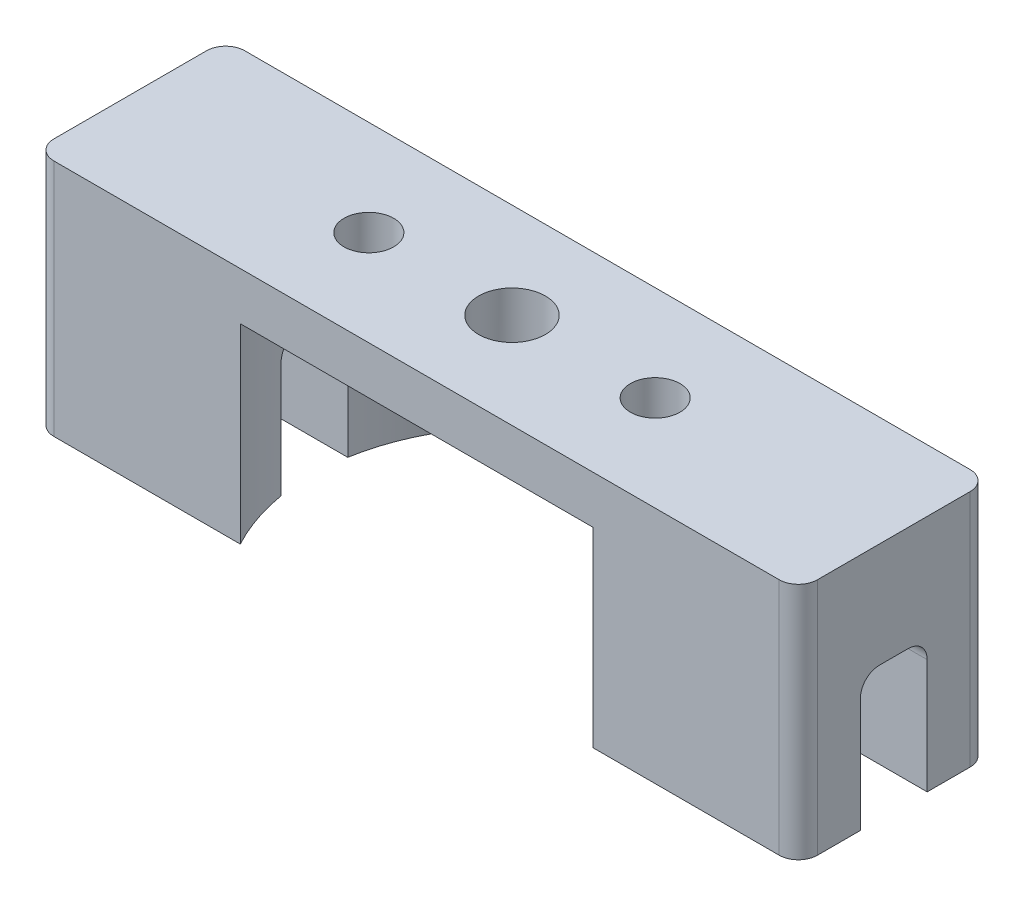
SolidWorks part; units mm, degrees
ref_plane "Front Plane" through (0, 0, 0) normal (0, 0, 1) x (1, 0, 0)
ref_plane "Top Plane" through (0, 0, 0) normal (0, 1, 0) x (1, 0, 0)
ref_plane "Right Plane" through (0, 0, 0) normal (1, 0, 0) x (0, 0, -1)
sketch "Sketch1" plane through (0, 0, 0) normal (0, 1, 0) x (1, 0, 0)
  line L1 (0, 0) -> (101.6, 0)
  line L2 (0, 0) -> (0, 25.4)
  line L3 (0, 25.4) -> (101.6, 25.4)
  line L4 (101.6, 0) -> (101.6, 25.4)
  dimension "D1" = 101.6
  dimension "D2" = 25.4
extrude "Boss-Extrude1" add sketch "Sketch1" along normal blind 31.75
sketch "Sketch2" plane through (101.6, 0, 0) normal (1, 0, 0) x (0, 0, -1)
  line L0 (12.7, 0) -> (12.7, 31.75) construction
  line L1 (0, 0) -> (25.4, 0) construction
  line L2 (0, 31.75) -> (25.4, 31.75) construction
  line L3 (8.255, 0) -> (8.255, 17.78)
  line L4 (8.255, 17.78) -> (17.145, 17.78)
  line L5 (12.7, 17.78) -> (12.7, 0)
  line L6 (17.145, 0) -> (8.255, 0)
  line L7 (17.145, 0) -> (17.145, 17.78)
  dimension "D1" = 4.445
  dimension "D2" = 17.78
extrude "Cut-Extrude1" cut sketch "Sketch2" against normal through all contours L7 L4 L5 M6 | L5 L4 L3 M6
fillet "Fillet1" radius 2.54 2 edges at (50.8, 17.78, -17.145) (50.8, 17.78, -8.255)
sketch "Sketch3" plane through (0, 0, 0) normal (0, -1, 0) x (1, 0, 0)
  line L0 (50.8, -25.4) -> (50.8, 0) construction
  line L1 (101.6, -25.4) -> (0, -25.4) construction
  line L2 (0, 0) -> (101.6, 0) construction
  line L3 (0, -12.7) -> (50.8, -12.7) construction
  line L4 (0, -10.795) -> (0, -14.605) construction
  circle A0 centre (50.8, -12.7) radius 26.67
  dimension "2.1" = 53.34
extrude "Cut-Extrude2" cut sketch "Sketch3" against normal blind 25.4
sketch "Sketch4" plane through (0, 31.75, 0) normal (0, 1, 0) x (1, 0, 0)
  line L0 (50.8, 0) -> (50.8, 25.4) construction
  line L1 (0, 0) -> (101.6, 0) construction
  line L2 (101.6, 25.4) -> (0, 25.4) construction
  line L3 (0, 12.7) -> (50.8, 12.7) construction
  line L4 (0, 25.4) -> (0, 0) construction
  circle A0 centre (50.8, 12.7) radius 4.445
  circle A1 centre (31.75, 12.7) radius 3.302
  circle A2 centre (69.85, 12.7) radius 3.302
  dimension "D1" = 8.89
  dimension "D2" = 6.604
  dimension "D3" = 19.05
extrude "Cut-Extrude3" cut sketch "Sketch4" against normal through all
fillet "Fillet2" radius 2.54 4 edges at (101.6, 15.875, -25.4) (101.6, 15.875, 0) (0, 15.875, -25.4) (0, 15.875, 0)
